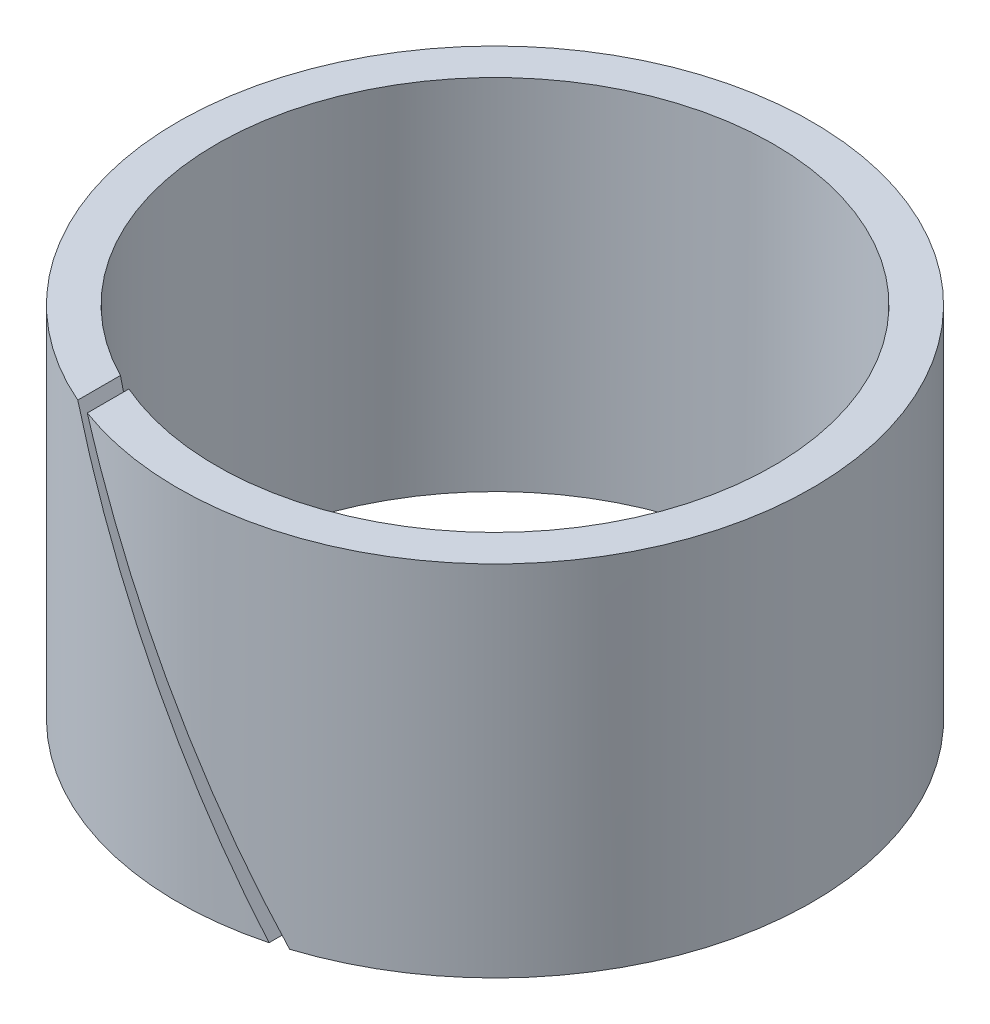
SolidWorks part; units mm, degrees
ref_plane "前基準面" through (0, 0, 0) normal (0, 0, 1) x (1, 0, 0)
ref_plane "上基準面" through (0, 0, 0) normal (0, 1, 0) x (1, 0, 0)
ref_plane "右基準面" through (0, 0, 0) normal (1, 0, 0) x (0, 0, -1)
sketch "草圖2" plane through (0, 0, 0) normal (1, 0, 0) x (0, 0, -1)
  line L0 (0, 6.9087) -> (0, -6.9087) construction
  line L2 (10.1, 0) -> (11.5, 0)
  line L3 (10.1, 0) -> (10.1, -13)
  line L4 (10.1, -13) -> (11.5, -13)
  line L5 (11.5, 0) -> (11.5, -13)
  dimension "D1" = 1.4
  dimension "D2" = 20.2
  dimension "D3" = 13
revolve "旋轉1" add sketch "草圖2" angle 360 about L0
sketch "草圖3" plane through (0, 0, 0) normal (0, 0, 1) x (1, 0, 0)
  line L1 (-4.5774, 0) -> (-4, 0)
  line L2 (11.5, 0) -> (-11.5, 0) construction
  line L3 (3.5056, -13) -> (2.9282, -13)
  line L4 (10.1, 0) -> (-10.1, 0) construction
  line L6 (-4, 0) -> (3.5056, -13)
  line L7 (-11.5, -13) -> (11.5, -13) construction
  line L10 (-4.5774, 0) -> (2.9282, -13)
  dimension "D2" = 0.5
  dimension "D1" = 60
  dimension "D3" = 4
extrude "除料-伸長1" cut sketch "草圖3" along normal through all
